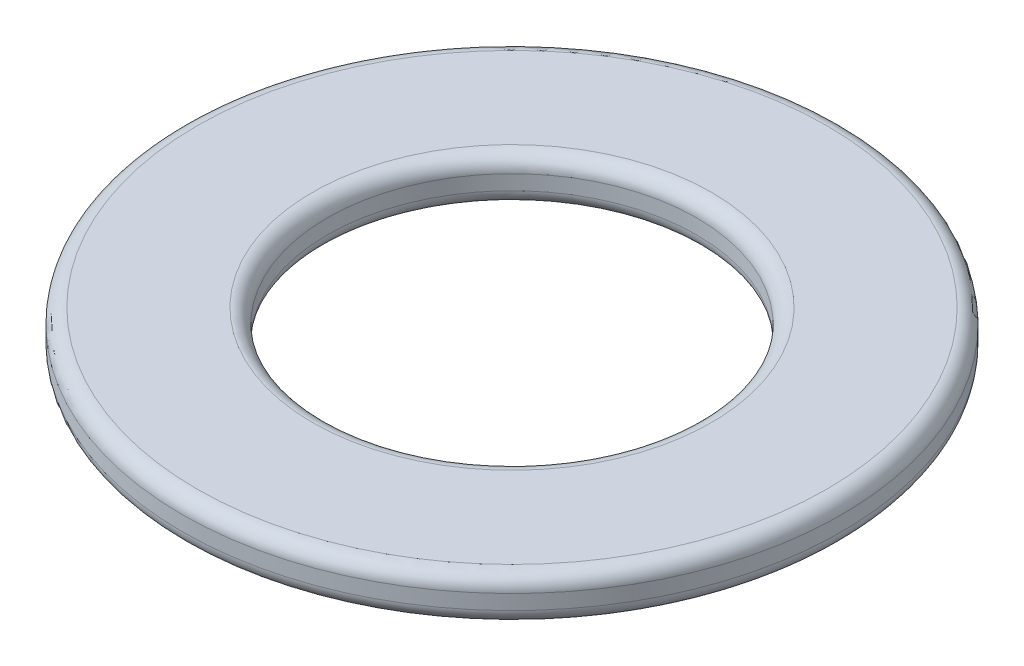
SolidWorks part; units mm, degrees
ref_plane "Front" through (0, 0, 0) normal (0, 0, 1) x (1, 0, 0)
ref_plane "Top" through (0, 0, 0) normal (0, 1, 0) x (1, 0, 0)
ref_plane "Right" through (0, 0, 0) normal (1, 0, 0) x (0, 0, -1)
sketch "Sketch1" plane through (0, 0, 0) normal (0, 1, 0) x (1, 0, 0)
  circle A0 centre (0, 0) radius 22.3169
  circle A1 centre (0, 0) radius 12.508
extrude "Boss-Extrude1" add sketch "Sketch1" along normal blind 3
fillet "Fillet1" radius 1 1 edges at (0, 3, 22.3169)
fillet "Fillet2" radius 1 1 edges at (0, 0, 22.3169)
fillet "Fillet3" radius 1 1 edges at (0, 3, 12.508)
fillet "Fillet4" radius 1 1 edges at (0, 0, 12.508)
